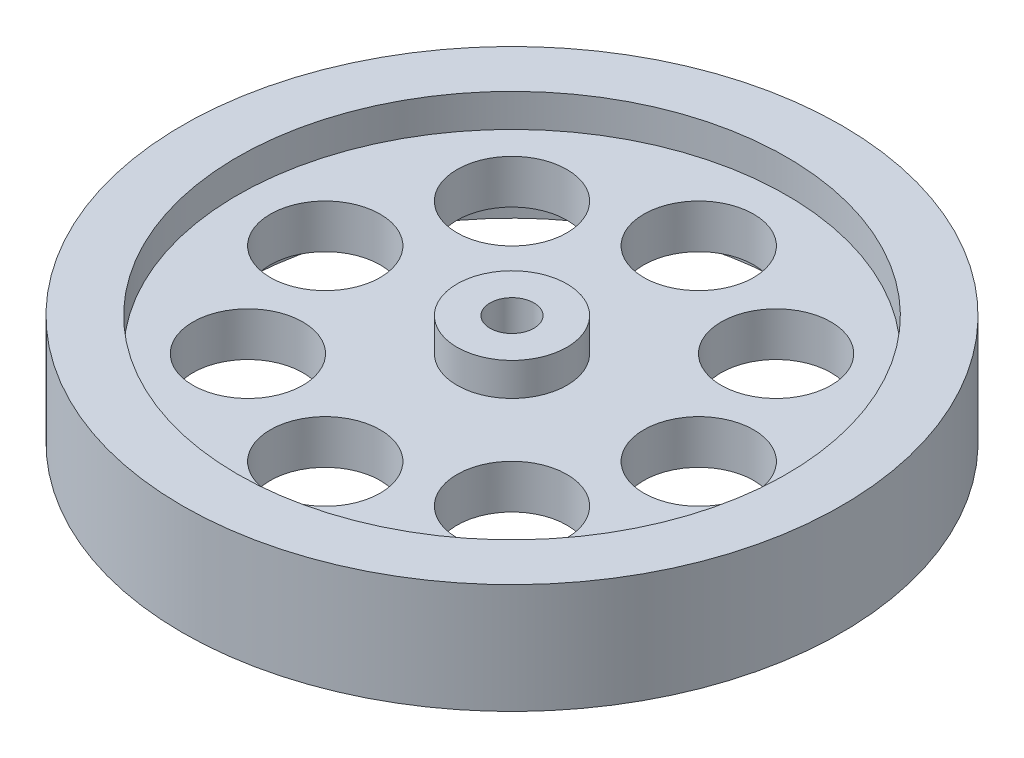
SolidWorks part; units mm, degrees
ref_plane "Front Plane" through (0, 0, 0) normal (0, 0, 1) x (1, 0, 0)
ref_plane "Top Plane" through (0, 0, 0) normal (0, 1, 0) x (1, 0, 0)
ref_plane "Right Plane" through (0, 0, 0) normal (1, 0, 0) x (0, 0, -1)
sketch "Sketch1" plane through (0, 0, 0) normal (0, 0, 1) x (1, 0, 0)
  line L0 (0, 0) -> (0, -50000) construction
  line L1 (0, 0) -> (50000, 0) construction
  line L3 (-30, 10) -> (-30, 0)
  line L4 (-5, 0) -> (-3, 0)
  line L5 (-2, 10) -> (-5, 10)
  line L6 (-2, 10) -> (-2, 4)
  line L7 (-5, 7) -> (-25, 7)
  line L8 (-2, 4) -> (-1.5, 4)
  line L9 (-1.5, 4) -> (-1.5, 1.5)
  line L10 (-1.5, 1.5) -> (-3, 0)
  line L11 (-25, 7) -> (-25, 10)
  line L12 (-25, 10) -> (-30, 10)
  line L13 (-30, 0) -> (-25, 0)
  line L14 (-25, 0) -> (-25, 3)
  line L15 (-25, 3) -> (-5, 3)
  line L16 (-5, 10) -> (-5, 7)
  line L17 (-5, 3) -> (-5, 0)
  dimension "D1" = 6
  dimension "D2" = 4
  dimension "D3" = 3
  dimension "D4" = 2.5
  dimension "D5" = 10
  dimension "D6" = 45
  dimension "D7" = 60
  dimension "D8" = 10
  dimension "D9" = 3
  dimension "D10" = 3
  dimension "D11" = 50
  dimension "D12" = 50
  dimension "D13" = 10
  dimension "D14" = 10
revolve "Revolve1" add sketch "Sketch1" angle 360 about L0
sketch "Sketch2" plane through (0, 3, 0) normal (0, -1, 0) x (1, 0, 0)
  circle A0 centre (0, 0) radius 17 construction
  circle A1 centre (-17, 0) radius 5
  circle A2 centre (-12.0208, 12.0208) radius 5
  circle A3 centre (0, 17) radius 5
  circle A4 centre (12.0208, 12.0208) radius 5
  circle A5 centre (17, 0) radius 5
  circle A6 centre (12.0208, -12.0208) radius 5
  circle A7 centre (0, -17) radius 5
  circle A8 centre (-12.0208, -12.0208) radius 5
  point P21 (0, 0)
  dimension "D1" = 34
  dimension "D2" = 10
  dimension "D3" = 8
extrude "Cut-Extrude2" cut sketch "Sketch2" against normal through all
